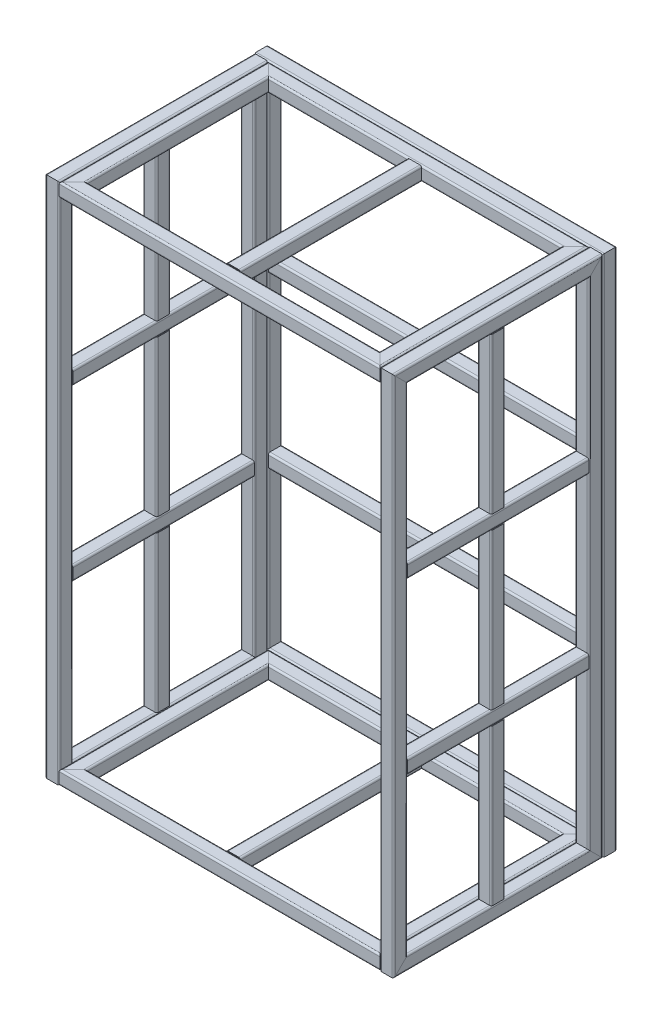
SolidWorks part; units mm, degrees
ref_plane "Płaszczyzna przednia" through (0, 0, 0) normal (0, 0, 1) x (1, 0, 0)
ref_plane "Płaszczyzna górna" through (0, 0, 0) normal (0, 1, 0) x (1, 0, 0)
ref_plane "Płaszczyzna prawa" through (0, 0, 0) normal (1, 0, 0) x (0, 0, -1)
sketch "Szkic podłogi" plane through (0, 0, 0) normal (0, 0, 1) x (1, 0, 0)
  line L0 (960, -1460) -> (960, 1460)
  line L1 (1000, -1500) -> (-1000, -1500) construction
  line L2 (1000, -1500) -> (1000, 1500) construction
  line L3 (1000, 1500) -> (-1000, 1500) construction
  line L4 (-1000, -1500) -> (-1000, 1500) construction
  line L5 (1000, -1500) -> (-1000, 1500) construction
  line L6 (1000, 1500) -> (-1000, -1500) construction
  line L7 (960, 1460) -> (-960, 1460)
  line L8 (-960, -1460) -> (-960, 1460)
  line L9 (960, -1460) -> (-960, -1460)
  line L10 (-960, 486.6667) -> (960, 486.6667)
  line L11 (-960, -486.6667) -> (960, -486.6667)
  line L12 (0, 1460) -> (0, 486.6667) construction
  line L13 (0, 486.6667) -> (0, -486.6667) construction
  line L14 (0, -486.6667) -> (0, -1460) construction
  point P0 (0, 0)
ref_plane "Pł. ściany bocznej" through (-960, 0, 0) normal (1, 0, 0) x (0, 0, -1)
sketch "Szkic ściany bocznej" plane through (-960, 0, 0) normal (1, 0, 0) x (0, 0, -1)
  line L0 (0, -1460) -> (0, 1460) construction
  line L1 (-40, -1500) -> (-1240, -1500) construction
  line L2 (-40, -1500) -> (-40, 1500) construction
  line L3 (-40, 1500) -> (-1240, 1500) construction
  line L4 (-1240, -1500) -> (-1240, 1500) construction
  line L5 (-80, -1460) -> (-1200, -1460)
  line L6 (-1200, -1460) -> (-1200, 1460)
  line L7 (-80, 1460) -> (-1200, 1460)
  line L8 (-80, -1460) -> (-80, 1460)
  line L9 (-1200, -486.6667) -> (-80, -486.6667)
  line L10 (-1200, 486.6667) -> (-80, 486.6667)
  line L11 (-640, -1460) -> (-640, -486.6667)
  line L12 (-640, -486.6667) -> (-640, 486.6667)
  line L13 (-640, 486.6667) -> (-640, 1460)
ref_plane "Pł. ściany przedniej" through (0, -1460, 0) normal (0, 1, 0) x (1, 0, 0)
sketch "Szkic ściany przedniej" plane through (0, -1460, 0) normal (0, 1, 0) x (1, 0, 0)
  line L1 (-880, -1200) -> (880, -1200)
  line L2 (-880, -1200) -> (-880, -80)
  line L3 (-880, -80) -> (880, -80)
  line L4 (880, -1200) -> (880, -80)
  line L5 (-960, -80) -> (-960, -1200) construction
  line L6 (0, 0) -> (0, -80) construction
  line L7 (0, -1200) -> (0, -80)
other "Profile podłogi"
ref_plane "Płaszczyzna3" through (960, -1460, 0) normal (-1, 0, 0) x (0, -1, 0)
sketch "Sketch15" plane through (960, -1460, 0) normal (-1, 0, 0) x (0, -1, 0)
  line L0 (-30, -35) -> (30, -35)
  line L1 (-35, -30) -> (-35, 30)
  line L2 (30, 35) -> (-30, 35)
  line L3 (35, 30) -> (35, -30)
  line L4 (-30, -40) -> (30, -40)
  line L5 (-40, -30) -> (-40, 30)
  line L6 (30, 40) -> (-30, 40)
  line L7 (40, 30) -> (40, -30)
  arc A0 (40, 30) -> (30, 40) centre (30, 30) ccw
  arc A1 (30, -40) -> (40, -30) centre (30, -30) ccw
  arc A2 (-40, -30) -> (-30, -40) centre (-30, -30) ccw
  arc A3 (-30, 40) -> (-40, 30) centre (-30, 30) ccw
  arc A4 (-30, 35) -> (-35, 30) centre (-30, 30) ccw
  arc A5 (35, 30) -> (30, 35) centre (30, 30) ccw
  arc A6 (30, -35) -> (35, -30) centre (30, -30) ccw
  arc A7 (-35, -30) -> (-30, -35) centre (-30, -30) ccw
  point P0 (-40, 0)
  point P1 (40, 0)
  point P2 (0, 40)
  point P3 (0, -40)
  point P4 (0, 0)
  point P5 (-40, -40)
  point P6 (40, -40)
  point P7 (40, 40)
  point P8 (-40, 40)
  point P33 (0, 0)
  dimension "D1" = 10
  dimension "Thickness" = 5
  dimension "V_leg" = 80
other "Profile ściany bocznej"
ref_plane "Płaszczyzna4" through (-960, -1460, 80) normal (0, 1, 0) x (0, 0, 1)
sketch "Sketch16" plane through (-960, -1460, 80) normal (0, 1, 0) x (0, 0, 1)
  line L0 (-30, -35) -> (30, -35)
  line L1 (-35, -30) -> (-35, 30)
  line L2 (30, 35) -> (-30, 35)
  line L3 (35, 30) -> (35, -30)
  line L4 (-30, -40) -> (30, -40)
  line L5 (-40, -30) -> (-40, 30)
  line L6 (30, 40) -> (-30, 40)
  line L7 (40, 30) -> (40, -30)
  arc A0 (40, 30) -> (30, 40) centre (30, 30) ccw
  arc A1 (30, -40) -> (40, -30) centre (30, -30) ccw
  arc A2 (-40, -30) -> (-30, -40) centre (-30, -30) ccw
  arc A3 (-30, 40) -> (-40, 30) centre (-30, 30) ccw
  arc A4 (-30, 35) -> (-35, 30) centre (-30, 30) ccw
  arc A5 (35, 30) -> (30, 35) centre (30, 30) ccw
  arc A6 (30, -35) -> (35, -30) centre (30, -30) ccw
  arc A7 (-35, -30) -> (-30, -35) centre (-30, -30) ccw
  point P0 (-40, 0)
  point P1 (40, 0)
  point P2 (0, 40)
  point P3 (0, -40)
  point P4 (0, 0)
  point P5 (-40, -40)
  point P6 (40, -40)
  point P7 (40, 40)
  point P8 (-40, 40)
  point P33 (0, 0)
  dimension "D1" = 10
  dimension "Thickness" = 5
  dimension "V_leg" = 80
other "Profile ściany przedniej"
ref_plane "Płaszczyzna5" through (-880, -1460, 1200) normal (0, 0, -1) x (-1, 0, 0)
sketch "Sketch1" plane through (-880, -1460, 1200) normal (0, 0, -1) x (-1, 0, 0)
  line L0 (-30, -35) -> (30, -35)
  line L1 (-35, -30) -> (-35, 30)
  line L2 (30, 35) -> (-30, 35)
  line L3 (35, 30) -> (35, -30)
  line L4 (-30, -40) -> (30, -40)
  line L5 (-40, -30) -> (-40, 30)
  line L6 (30, 40) -> (-30, 40)
  line L7 (40, 30) -> (40, -30)
  arc A0 (40, 30) -> (30, 40) centre (30, 30) ccw
  arc A1 (30, -40) -> (40, -30) centre (30, -30) ccw
  arc A2 (-40, -30) -> (-30, -40) centre (-30, -30) ccw
  arc A3 (-30, 40) -> (-40, 30) centre (-30, 30) ccw
  arc A4 (-30, 35) -> (-35, 30) centre (-30, 30) ccw
  arc A5 (35, 30) -> (30, 35) centre (30, 30) ccw
  arc A6 (30, -35) -> (35, -30) centre (30, -30) ccw
  arc A7 (-35, -30) -> (-30, -35) centre (-30, -30) ccw
  point P0 (-40, 0)
  point P1 (40, 0)
  point P2 (0, 40)
  point P3 (0, -40)
  point P4 (0, 0)
  point P5 (-40, -40)
  point P6 (40, -40)
  point P7 (40, 40)
  point P8 (-40, 40)
  point P33 (0, 0)
  dimension "D1" = 10
  dimension "Thickness" = 5
  dimension "V_leg" = 80
mirror "Lustro1" about plane through (0, 0, 0) normal (1, 0, 0)
mirror "Lustro2" about plane through (0, 0, 0) normal (0, 1, 0)
equation "\"Połowa szer.profilu@Szkic podłogi\" = \"Szerokość profilu\" / 2"
equation "\"Szerokość profilu@Szkic ściany przedniej\" = \"Szerokość profilu\""
equation "\"Połowa szer.profilu@Szkic ściany bocznej\" = \"Szerokość profilu\" / 2"
equation "\"Połowa szer.profilu2@Szkic ściany bocznej\"= \"Szerokość profilu\" / 2"
equation "\"Szerokość profilu\"= 80"
